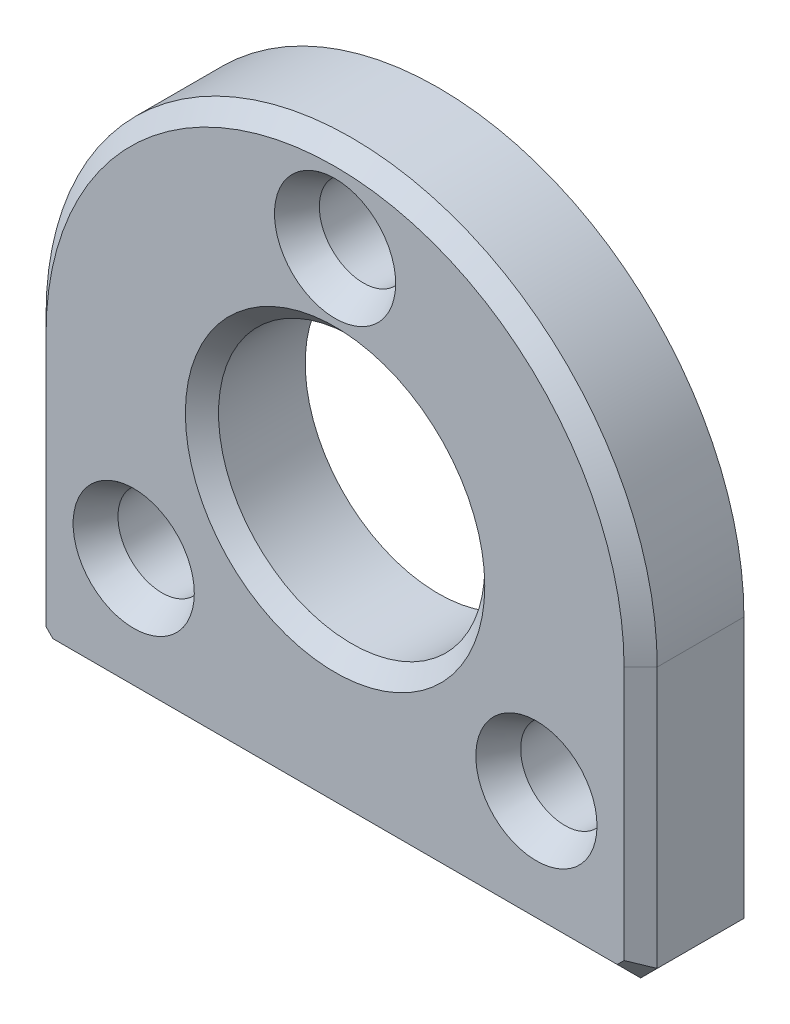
SolidWorks part; units mm, degrees
ref_plane "Спереди" through (0, 0, 0) normal (0, 0, 1) x (1, 0, 0)
ref_plane "Сверху" through (0, 0, 0) normal (0, 1, 0) x (1, 0, 0)
ref_plane "Справа" through (0, 0, 0) normal (1, 0, 0) x (0, 0, -1)
sketch "Эскиз1" plane through (0, 0, 0) normal (0, 0, 1) x (1, 0, 0)
  line L0 (0, -33.0222) -> (0, 16.3576) construction
  line L1 (-16.383, -0.0254) -> (-16.383, -14.0208)
  line L2 (-15.494, -14.9098) -> (15.494, -14.9098)
  line L3 (16.383, -14.0208) -> (16.383, -0.0254)
  line L4 (15.494, -14.9098) -> (16.383, -14.0208)
  line L5 (-16.383, -14.0208) -> (-15.494, -14.9098)
  circle A0 centre (0, 0) radius 7.1374
  arc A1 (16.383, -0.0254) -> (-16.383, -0.0254) centre (0, -0.0254) ccw
  circle A2 centre (0, 11.6586) radius 2.3685
  circle A3 centre (-10.795, -8.128) radius 2.3686
  circle A4 centre (10.795, -8.128) radius 2.3686
  point P6 (-16.383, -14.9098)
  point P8 (16.383, -14.9098)
  dimension "D1" = 14.2748
  dimension "D5" = 4.7371
  dimension "D2" = 32.766
  dimension "D3" = 31.2674
  dimension "D4" = 14.9098
  dimension "D6" = 10.795
  dimension "D7" = 6.7818
  dimension "D8" = 26.5684
extrude "Бобышка-Вытянуть1" add sketch "Эскиз1" along normal blind 5.5372
chamfer "Фаска1" distance 0.889 angle 45 6 edges at (16.383, -7.0231, 5.5372) (15.9385, -14.4653, 5.5372) (0, -14.9098, 5.5372) (-15.9385, -14.4653, 5.5372) (-16.383, -7.0231, 5.5372) (0, 16.3576, 5.5372)
chamfer "Фаска2" distance 1.524 angle 30 3 edges at (13.1635, -8.128, 5.5372) (2.3685, 11.6586, 5.5372) (-8.4264, -8.128, 5.5372)
